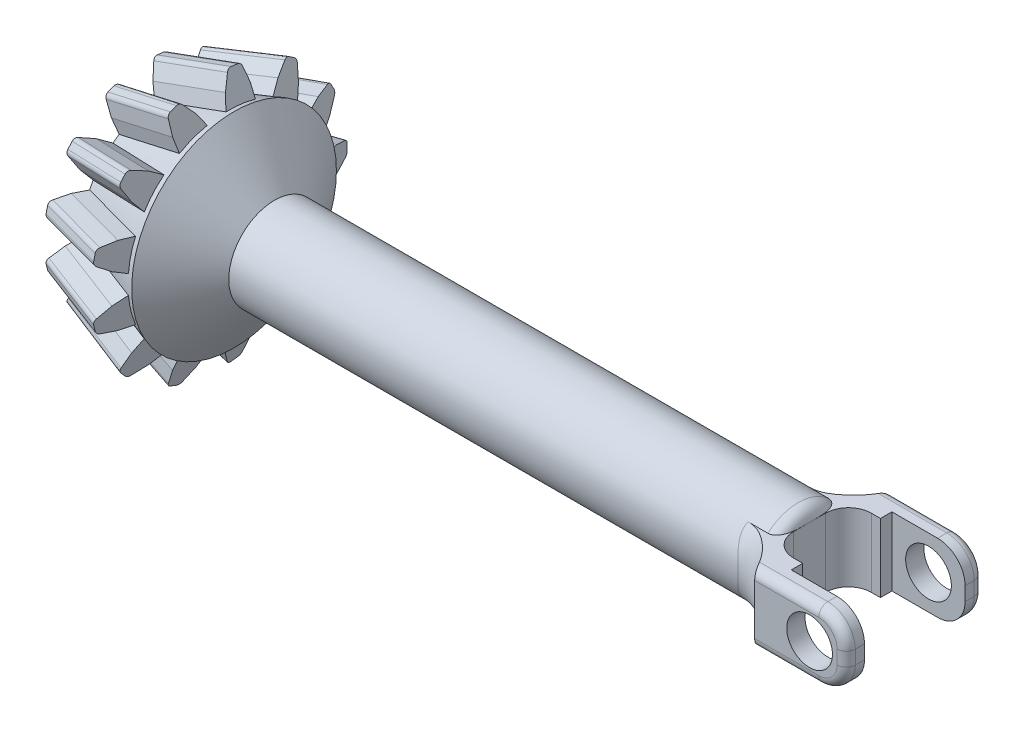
SolidWorks part; units mm, degrees
ref_plane "Front Plane" through (0, 0, 0) normal (0, 0, 1) x (1, 0, 0)
ref_plane "Top Plane" through (0, 0, 0) normal (0, 1, 0) x (1, 0, 0)
ref_plane "Right Plane" through (0, 0, 0) normal (1, 0, 0) x (0, 0, -1)
sketch "Sketch1" plane through (0, 0, 0) normal (1, 0, 0) x (0, 0, -1)
  circle A0 centre (0, 0) radius 27.94
  dimension "D1" = 55.88
extrude "Boss-Extrude1" add sketch "Sketch1" along normal blind 19.05
chamfer "Chamfer1" distance 6.35 distance2 19.05 1 edges at (0, 0, -27.94)
sketch "Sketch5" plane through (0, 0, 0) normal (-1, 0, 0) x (0, 0, 1)
  line L0 (0, -21.59) -> (0, 21.59) construction
  circle A0 centre (0, 0) radius 21.59 construction
ref_plane "Plane3" through (0, 0, 0) normal (-0.9466, 0, 0.3223) x (0, 1, 0)
sketch "Sketch6" plane through (0, 0, 0) normal (-0.9466, 0, 0.3223) x (0, 1, 0)
  line L0 (-4.1275, 20.061) -> (4.1275, 20.061)
  line L1 (4.1275, 20.061) -> (3.4557, 23.871)
  line L2 (3.4557, 23.871) -> (2.0958, 27.6074)
  line L3 (0.9024, 28.443) -> (-0.9024, 28.443)
  line L4 (-2.0958, 27.6074) -> (-3.4557, 23.871)
  line L5 (-3.4557, 23.871) -> (-4.1275, 20.061)
  arc A0 (2.0958, 27.6074) -> (0.9024, 28.443) centre (0.9024, 27.173) ccw
  arc A1 (-0.9024, 28.443) -> (-2.0958, 27.6074) centre (-0.9024, 27.173) ccw
  ellipse E0 centre (0, 0) end of major axis (21.59, 0) minor radius 20.438 construction
  point P17 (-1.7916, 28.443)
  dimension "D6" = 1.27
  dimension "D1" = 80
  dimension "D2" = 3.81
  dimension "D3" = 110
  dimension "D4" = 8.255
  dimension "D5" = 4.572
extrude "Boss-Extrude3" add sketch "Sketch6" against normal blind 26.924
pattern_circular "CirPattern1" count 13 over 360 about axis through (0, 0, 0) along (1, 0, 0) of "Boss-Extrude3"
sketch "Sketch7" plane through (0, 0, 0) normal (-1, 0, 0) x (0, 0, 1)
  line L0 (0, -21.59) -> (0, 21.59) construction
  circle A0 centre (0, 0) radius 21.59
  arc A1 (-15.4352, 15.0958) -> (-16.8463, 13.503) centre (0, 0) ccw construction
extrude "Cut-Extrude2" cut sketch "Sketch7" along normal blind 11.684 draft 65
sketch "Sketch8" plane through (19.05, 0, 0) normal (1, 0, 0) x (0, 0, -1)
  circle A0 centre (0, 0) radius 12.7
  dimension "D1" = 25.4
extrude "Boss-Extrude4" add sketch "Sketch8" along normal blind 165.1
sketch "Sketch9" plane through (184.15, 0, 0) normal (1, 0, 0) x (0, 0, -1)
  line L1 (-19.05, 9.525) -> (19.05, 9.525)
  line L2 (-19.05, 9.525) -> (-19.05, -9.525)
  line L3 (-19.05, -9.525) -> (19.05, -9.525)
  line L4 (19.05, 9.525) -> (19.05, -9.525)
  dimension "D1" = 19.05
  dimension "D2" = 9.525
  dimension "D3" = 19.05
  dimension "D4" = 19.05
extrude "Boss-Extrude5" add sketch "Sketch9" along normal blind 25.4
sketch "Sketch10" plane through (0, 9.525, 0) normal (0, 1, 0) x (1, 0, 0)
  line L0 (209.55, 19.05) -> (209.55, -19.05) construction
  line L1 (209.55, 13.97) -> (189.23, 13.97)
  line L2 (209.55, 13.97) -> (209.55, -13.97)
  line L3 (209.55, -13.97) -> (189.23, -13.97)
  line L4 (189.23, 13.97) -> (189.23, -13.97)
  line L5 (184.15, -8.4003) -> (184.15, 8.4003) construction
  line L6 (209.55, 19.05) -> (184.15, 19.05) construction
  line L7 (209.55, -19.05) -> (184.15, -19.05) construction
  dimension "D1" = 5.08
  dimension "D2" = 5.08
  dimension "D3" = 5.08
extrude "Cut-Extrude3" cut sketch "Sketch10" against normal blind 25.4
sketch "Sketch11" plane through (0, 0, 19.05) normal (0, 0, 1) x (1, 0, 0)
  line L0 (209.55, -9.525) -> (184.15, -9.525) construction
  line L1 (209.55, 9.525) -> (209.55, -9.525) construction
  circle A0 centre (199.39, 0) radius 6.35
  dimension "D1" = 12.7
  dimension "D2" = 9.525
  dimension "D3" = 10.16
extrude "Cut-Extrude4" cut sketch "Sketch11" against normal blind 38.1
fillet "Fillet1" radius 7.62 4 edges at (209.55, -9.525, -16.51) (209.55, -9.525, 16.51) (209.55, 9.525, 16.51) (209.55, 9.525, -16.51)
fillet "Fillet2" radius 12.7 2 edges at (184.15, 0, -12.7) (184.15, 0, 12.7)
sketch "Sketch13" plane through (189.23, 0, 0) normal (1, 0, 0) x (0, 0, -1)
  line L1 (10.795, 12.7) -> (-10.795, 12.7)
  line L2 (10.795, 12.7) -> (10.795, -12.7)
  line L3 (10.795, -12.7) -> (-10.795, -12.7)
  line L4 (-10.795, 12.7) -> (-10.795, -12.7)
  arc A0 (8.4003, 9.525) -> (-8.4003, 9.525) centre (0, 0) ccw construction
  arc A1 (-8.4003, -9.525) -> (8.4003, -9.525) centre (0, 0) ccw construction
  point P5 (0, 12.7)
  dimension "D1" = 21.59
extrude "Cut-Extrude5" cut sketch "Sketch13" against normal blind 8.89
fillet "Fillet3" radius 3.175 2 edges at (180.34, -12.7, 0) (180.34, 12.7, 0)
fillet "Fillet4" radius 6.35 2 edges at (180.34, 0, 10.795) (180.34, 0, -10.795)
fillet "Fillet5" radius 2.54 10 edges at (193.04, -9.525, -19.05) (207.3182, -7.2932, -19.05) (193.04, 9.525, -19.05) (207.3182, 7.2932, -19.05) (193.04, 9.525, 19.05) (207.3182, 7.2932, 19.05) (193.04, -9.525, 19.05) (207.3182, -7.2932, 19.05) (209.55, 0, -19.05) (209.55, 0, 19.05)
chamfer "Chamfer2" distance 17.78 distance2 12.7 1 edges at (19.05, 0, -12.7)
ref_plane "Plane8" through (104.775, 0, 0) normal (1, 0, 0) x (0, 0, -1)
